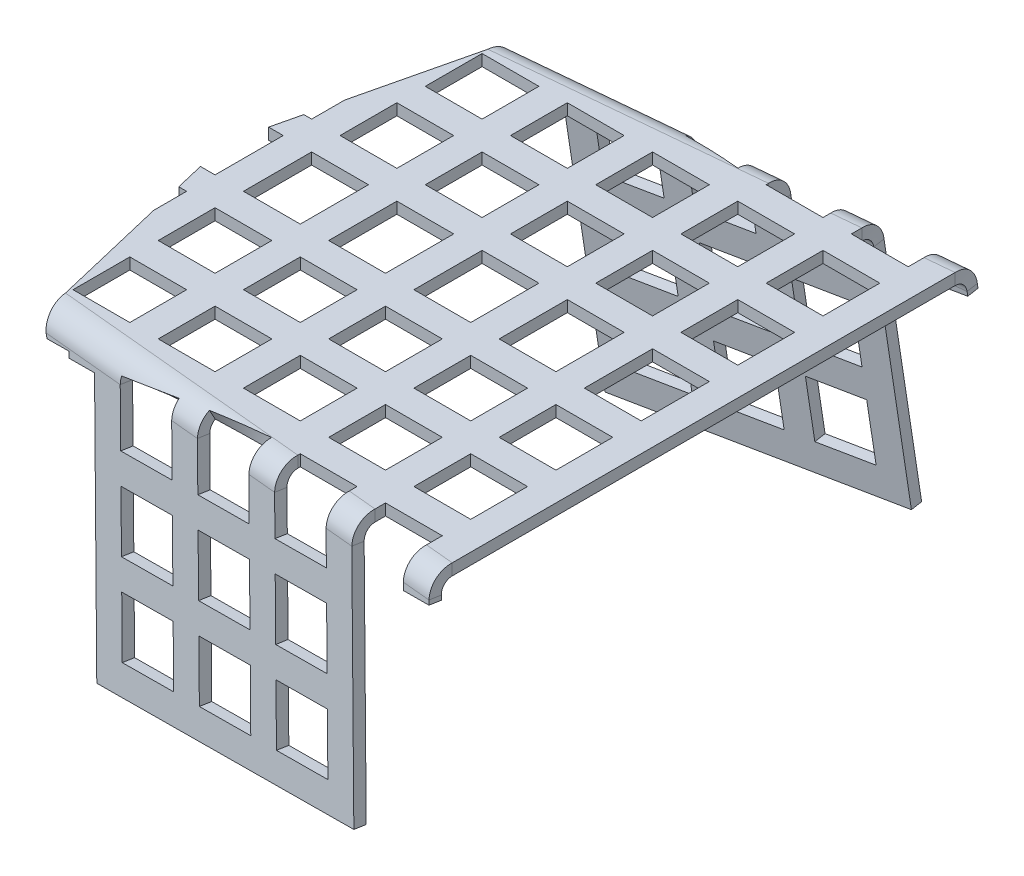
SolidWorks part; units mm, degrees
ref_plane "Front Plane" through (0, 0, 0) normal (0, 0, 1) x (1, 0, 0)
ref_plane "Top Plane" through (0, 0, 0) normal (0, 1, 0) x (1, 0, 0)
ref_plane "Right Plane" through (0, 0, 0) normal (1, 0, 0) x (0, 0, -1)
sketch "Sketch1" plane through (0, 0, 0) normal (0, 1, 0) x (1, 0, 0)
  line L0 (0, 0) -> (-42, 0) construction
  line L1 (0, -24) -> (0, 24)
  line L2 (0, 24) -> (-2.5, 24)
  line L3 (-7.5, 20.5) -> (-7.5, 43)
  line L4 (-7.5, 43) -> (-32.5, 43)
  line L5 (-32.5, 43) -> (-32.5, 21)
  line L6 (-32.5, 21) -> (-35, 21)
  line L7 (-37.119, 20.5) -> (-40, 8.4)
  line L8 (-10, 33) -> (-15, 33)
  line L9 (-10, 40.5) -> (-15, 40.5)
  line L10 (-10, 40.5) -> (-10, 35.5)
  line L11 (-10, 35.5) -> (-15, 35.5)
  line L12 (-15, 40.5) -> (-15, 35.5)
  line L13 (-17.5, 40.5) -> (-22.5, 40.5)
  line L14 (-17.5, 40.5) -> (-17.5, 35.5)
  line L15 (-17.5, 35.5) -> (-22.5, 35.5)
  line L16 (-22.5, 40.5) -> (-22.5, 35.5)
  line L17 (-25, 40.5) -> (-30, 40.5)
  line L18 (-25, 40.5) -> (-25, 35.5)
  line L19 (-25, 35.5) -> (-30, 35.5)
  line L20 (-30, 40.5) -> (-30, 35.5)
  line L21 (-10, 28) -> (-15, 28)
  line L22 (-15, 33) -> (-15, 28)
  line L23 (-10, 33) -> (-10, 28)
  line L24 (-17.5, 33) -> (-17.5, 28)
  line L25 (-17.5, 33) -> (-22.5, 33)
  line L26 (-22.5, 33) -> (-22.5, 28)
  line L27 (-17.5, 28) -> (-22.5, 28)
  line L28 (-25, 33) -> (-25, 28)
  line L29 (-25, 33) -> (-30, 33)
  line L30 (-30, 33) -> (-30, 28)
  line L31 (-25, 28) -> (-30, 28)
  line L32 (-35, -21) -> (-35, -20.5)
  line L33 (-10, 25.5) -> (-15, 25.5)
  line L34 (-10, 20.5) -> (-15, 20.5)
  line L35 (-15, 25.5) -> (-15, 20.5)
  line L36 (-10, 25.5) -> (-10, 20.5)
  line L37 (-17.5, 25.5) -> (-17.5, 20.5)
  line L38 (-17.5, 25.5) -> (-22.5, 25.5)
  line L39 (-22.5, 25.5) -> (-22.5, 20.5)
  line L40 (-17.5, 20.5) -> (-22.5, 20.5)
  line L41 (-25, 25.5) -> (-25, 20.5)
  line L42 (-25, 25.5) -> (-30, 25.5)
  line L43 (-30, 25.5) -> (-30, 20.5)
  line L44 (-25, 20.5) -> (-30, 20.5)
  line L45 (-2.5, 20.5) -> (-7.5, 20.5)
  line L46 (-10, 18) -> (-15, 18)
  line L47 (-10, 13) -> (-15, 13)
  line L48 (-15, 18) -> (-15, 13)
  line L49 (-10, 18) -> (-10, 13)
  line L50 (-17.5, 18) -> (-17.5, 13)
  line L51 (-17.5, 18) -> (-22.5, 18)
  line L52 (-22.5, 18) -> (-22.5, 13)
  line L53 (-17.5, 13) -> (-22.5, 13)
  line L54 (-25, 18) -> (-25, 13)
  line L55 (-25, 18) -> (-30, 18)
  line L56 (-30, 18) -> (-30, 13)
  line L57 (-25, 13) -> (-30, 13)
  line L58 (-35, -20.5) -> (-37.119, -20.5)
  line L59 (-10, 10.5) -> (-15, 10.5)
  line L60 (-10, 5.5) -> (-15, 5.5)
  line L61 (-15, 10.5) -> (-15, 5.5)
  line L62 (-10, 10.5) -> (-10, 5.5)
  line L63 (-17.5, 10.5) -> (-17.5, 5.5)
  line L64 (-17.5, 10.5) -> (-22.5, 10.5)
  line L65 (-22.5, 10.5) -> (-22.5, 5.5)
  line L66 (-17.5, 5.5) -> (-22.5, 5.5)
  line L67 (-25, 10.5) -> (-25, 5.5)
  line L68 (-25, 10.5) -> (-30, 10.5)
  line L69 (-30, 10.5) -> (-30, 5.5)
  line L70 (-25, 5.5) -> (-30, 5.5)
  line L71 (-2.5, 24) -> (-2.5, 20.5)
  line L72 (-10, 3) -> (-15, 3)
  line L73 (-40.6905, 5.5) -> (-41.2857, 3)
  line L74 (-15, 3) -> (-15, -3)
  line L75 (-10, 3) -> (-10, -3)
  line L76 (-17.5, 3) -> (-17.5, -3)
  line L77 (-17.5, 3) -> (-22.5, 3)
  line L78 (-22.5, 3) -> (-22.5, -3)
  line L79 (-40, -3) -> (-41.2857, -3)
  line L80 (-25, 3) -> (-25, -3)
  line L81 (-25, 3) -> (-30, 3)
  line L82 (-30, 3) -> (-30, -3)
  line L83 (-40, -5.5) -> (-40.6905, -5.5)
  line L84 (-2.5, 18) -> (-7.5, 18)
  line L85 (-32.5, 5.5) -> (-32.5, -16.5)
  line L86 (-32.5, 13) -> (-32.5, -9)
  line L87 (-32.5, 20.5) -> (-32.5, -1.5)
  line L88 (-32.5, 28) -> (-32.5, 6)
  line L89 (-32.5, 35.5) -> (-32.5, 13.5)
  line L90 (-2.5, 18) -> (-2.5, 13)
  line L91 (-2.5, 13) -> (-7.5, 13)
  line L92 (-7.5, 18) -> (-7.5, 13)
  line L93 (-2.5, 10.5) -> (-7.5, 10.5)
  line L94 (-2.5, 10.5) -> (-2.5, 5.5)
  line L95 (-7.5, 10.5) -> (-7.5, 5.5)
  line L96 (-2.5, 5.5) -> (-7.5, 5.5)
  line L97 (-2.5, 3) -> (-7.5, 3)
  line L98 (-2.5, 3) -> (-2.5, -3)
  line L99 (-7.5, 3) -> (-7.5, -3)
  line L100 (-32.5, 18) -> (-37.5, 18)
  line L101 (-32.5, 18) -> (-32.5, 13)
  line L102 (-32.5, 13) -> (-37.5, 13)
  line L103 (-37.5, 18) -> (-37.5, 13)
  line L104 (-32.5, 10.5) -> (-37.5, 10.5)
  line L105 (-32.5, 10.5) -> (-32.5, 5.5)
  line L106 (-32.5, 5.5) -> (-37.5, 5.5)
  line L107 (-37.5, 10.5) -> (-37.5, 5.5)
  line L108 (-32.5, 3) -> (-37.5, 3)
  line L109 (-32.5, 3) -> (-32.5, -3)
  line L110 (-40, -8.4) -> (-40, -5.5)
  line L111 (-37.5, 3) -> (-37.5, -3)
  line L112 (-32.5, -3) -> (-37.5, -3)
  line L113 (-37.5, -10.5) -> (-37.5, -5.5)
  line L114 (-32.5, -5.5) -> (-37.5, -5.5)
  line L115 (-32.5, -10.5) -> (-32.5, -5.5)
  line L116 (-32.5, -10.5) -> (-37.5, -10.5)
  line L117 (-40, 8.4) -> (-40, 5.5)
  line L118 (-40, 5.5) -> (-40.6905, 5.5)
  line L119 (-37.5, -18) -> (-37.5, -13)
  line L120 (-40, 3) -> (-41.2857, 3)
  line L121 (-40, 3) -> (-40, -3)
  line L122 (-32.5, -13) -> (-37.5, -13)
  line L123 (-32.5, -18) -> (-32.5, -13)
  line L124 (-35, 20.5) -> (-37.119, 20.5)
  line L125 (-35, 21) -> (-35, 20.5)
  line L126 (-32.5, -18) -> (-37.5, -18)
  line L127 (-2.5, -3) -> (-7.5, -3)
  line L128 (-45, 3) -> (-45, -2)
  line L129 (-40, -2) -> (-45, -2)
  line L130 (-32.5, -2) -> (-37.5, -2)
  line L131 (-17.5, -2) -> (-22.5, -2)
  line L132 (-10, -2) -> (-15, -2)
  line L133 (-25, -2) -> (-30, -2)
  line L134 (-25, -2) -> (-30, -2)
  line L135 (-35, 25.5) -> (-40, 25.5)
  line L136 (-40, 25.5) -> (-40, 20.5)
  line L137 (-40, 18) -> (-45, 18)
  line L138 (-40, 18) -> (-40, 13)
  line L139 (-40, 13) -> (-45, 13)
  line L140 (-45, 18) -> (-45, 13)
  line L141 (-40, 10.5) -> (-45, 10.5)
  line L142 (-45, 10.5) -> (-45, 5.5)
  line L143 (-2.5, 25.5) -> (-7.5, 25.5)
  line L144 (-7.5, 25.5) -> (-7.5, 20.5)
  line L145 (-2.5, -5.5) -> (-7.5, -5.5)
  line L146 (-7.5, -10.5) -> (-7.5, -5.5)
  line L147 (-2.5, -10.5) -> (-2.5, -5.5)
  line L148 (-2.5, -10.5) -> (-7.5, -10.5)
  line L149 (-7.5, -18) -> (-7.5, -13)
  line L150 (-2.5, -13) -> (-7.5, -13)
  line L151 (-2.5, -18) -> (-2.5, -13)
  line L152 (-2.5, -18) -> (-7.5, -18)
  line L153 (-25, -3) -> (-30, -3)
  line L154 (-17.5, -3) -> (-22.5, -3)
  line L155 (-40.6905, -5.5) -> (-41.2857, -3)
  line L156 (-10, -3) -> (-15, -3)
  line L157 (-2.5, -24) -> (-2.5, -20.5)
  line L158 (-25, -5.5) -> (-30, -5.5)
  line L159 (-30, -10.5) -> (-30, -5.5)
  line L160 (-25, -10.5) -> (-30, -10.5)
  line L161 (-25, -10.5) -> (-25, -5.5)
  line L162 (-17.5, -5.5) -> (-22.5, -5.5)
  line L163 (-22.5, -10.5) -> (-22.5, -5.5)
  line L164 (-17.5, -10.5) -> (-22.5, -10.5)
  line L165 (-17.5, -10.5) -> (-17.5, -5.5)
  line L166 (-10, -10.5) -> (-10, -5.5)
  line L167 (-15, -10.5) -> (-15, -5.5)
  line L168 (-10, -5.5) -> (-15, -5.5)
  line L169 (-10, -10.5) -> (-15, -10.5)
  line L170 (-25, -13) -> (-30, -13)
  line L171 (-30, -18) -> (-30, -13)
  line L172 (-25, -18) -> (-30, -18)
  line L173 (-25, -18) -> (-25, -13)
  line L174 (-17.5, -13) -> (-22.5, -13)
  line L175 (-22.5, -18) -> (-22.5, -13)
  line L176 (-17.5, -18) -> (-22.5, -18)
  line L177 (-17.5, -18) -> (-17.5, -13)
  line L178 (-10, -18) -> (-10, -13)
  line L179 (-15, -18) -> (-15, -13)
  line L180 (-10, -13) -> (-15, -13)
  line L181 (-10, -18) -> (-15, -18)
  line L182 (-2.5, -20.5) -> (-7.5, -20.5)
  line L183 (-25, -20.5) -> (-30, -20.5)
  line L184 (-30, -25.5) -> (-30, -20.5)
  line L185 (-25, -25.5) -> (-30, -25.5)
  line L186 (-25, -25.5) -> (-25, -20.5)
  line L187 (-17.5, -20.5) -> (-22.5, -20.5)
  line L188 (-22.5, -25.5) -> (-22.5, -20.5)
  line L189 (-17.5, -25.5) -> (-22.5, -25.5)
  line L190 (-17.5, -25.5) -> (-17.5, -20.5)
  line L191 (-10, -25.5) -> (-10, -20.5)
  line L192 (-15, -25.5) -> (-15, -20.5)
  line L193 (-10, -20.5) -> (-15, -20.5)
  line L194 (-10, -25.5) -> (-15, -25.5)
  line L195 (-25, -28) -> (-30, -28)
  line L196 (-30, -33) -> (-30, -28)
  line L197 (-25, -33) -> (-30, -33)
  line L198 (-25, -33) -> (-25, -28)
  line L199 (-17.5, -28) -> (-22.5, -28)
  line L200 (-22.5, -33) -> (-22.5, -28)
  line L201 (-17.5, -33) -> (-22.5, -33)
  line L202 (-17.5, -33) -> (-17.5, -28)
  line L203 (-10, -33) -> (-10, -28)
  line L204 (-15, -33) -> (-15, -28)
  line L205 (-10, -28) -> (-15, -28)
  line L206 (-30, -40.5) -> (-30, -35.5)
  line L207 (-25, -35.5) -> (-30, -35.5)
  line L208 (-25, -40.5) -> (-25, -35.5)
  line L209 (-25, -40.5) -> (-30, -40.5)
  line L210 (-22.5, -40.5) -> (-22.5, -35.5)
  line L211 (-17.5, -35.5) -> (-22.5, -35.5)
  line L212 (-17.5, -40.5) -> (-17.5, -35.5)
  line L213 (-17.5, -40.5) -> (-22.5, -40.5)
  line L214 (-15, -40.5) -> (-15, -35.5)
  line L215 (-10, -35.5) -> (-15, -35.5)
  line L216 (-10, -40.5) -> (-10, -35.5)
  line L217 (-10, -40.5) -> (-15, -40.5)
  line L218 (-10, -33) -> (-15, -33)
  line L219 (-37.119, -20.5) -> (-40, -8.4)
  line L220 (-32.5, -21) -> (-35, -21)
  line L221 (-32.5, -43) -> (-32.5, -21)
  line L222 (-7.5, -43) -> (-32.5, -43)
  line L223 (-7.5, -20.5) -> (-7.5, -43)
  line L224 (0, -24) -> (-2.5, -24)
  point P105 (-7.5, 0)
  point P108 (-2.5, 0)
  point P136 (-10, 0)
  point P137 (-15, 0)
  point P138 (-17.5, 0)
  point P139 (-22.5, 0)
  point P140 (-25, 0)
  point P141 (-30, 0)
  point P142 (-32.5, 0)
  point P143 (-37.5, 0)
  point P260 (-40, 0)
  dimension "D1" = 24
  dimension "D2" = 43
  dimension "D3" = 42
  dimension "D5" = 25
  dimension "D6" = 21
  dimension "D8" = 5
  dimension "D9" = 5
  dimension "D10" = 5
  dimension "D11" = 5
  dimension "D12" = 5
  dimension "D13" = 5
  dimension "D14" = 2.5
  dimension "D15" = 2.5
  dimension "D16" = 2.5
  dimension "D17" = 2.5
  dimension "D18" = 2.5
  dimension "D19" = 2.5
sheet metal parameters "Sheet-Metal1" thickness 1 parameters "D1"=1
base flange "Base-Flange1" sketch "Sketch1" thickness 1 reverse thickness direction yes parameters "D1"=1
sketch "Sketch3" plane through (0, 1, 0) normal (0, 1, 0) x (1, 0, 0)
  line L0 (0, 24) -> (-37.119, 20.5)
  line L1 (0, -24) -> (-37.119, -20.5)
  line L2 (-40, 0) -> (0, 0) construction
  line L3 (-40, 3) -> (-40, -3) construction
  dimension "D1" = 5.387
sketched bend "Sketched Bend1" parameters "D1"=0
bend "SketchBend1" bend radius 1 bend angle 86 parameters "D5"=1
bend "SketchBend2" bend radius 0 bend angle 86 parameters "D5"=2
flat pattern "Flat-Pattern1"
sketch "Bend-Lines1" plane through (0, 0, 0) normal (0, 1, 0) x (-1, 0, 0)
bend of the flat pattern "Flatten-<SketchBend1>1"
bend of the flat pattern "Flatten-<SketchBend2>1"
